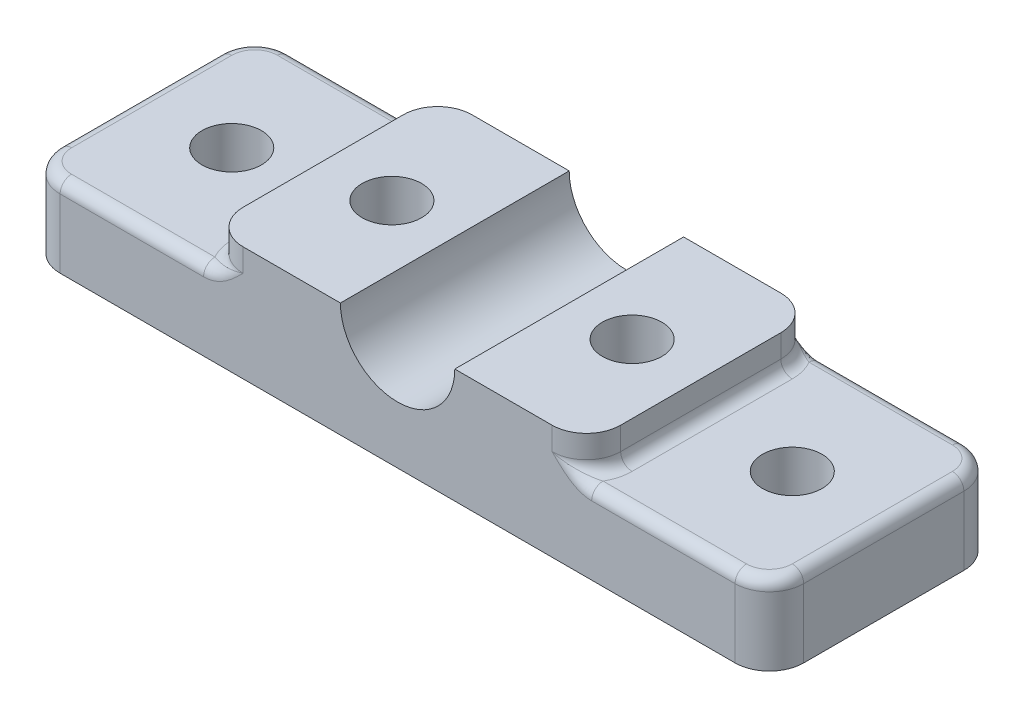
SolidWorks part; units mm, degrees
ref_plane "Front Plane" through (0, 0, 0) normal (0, 0, 1) x (1, 0, 0)
ref_plane "Top Plane" through (0, 0, 0) normal (0, 1, 0) x (1, 0, 0)
ref_plane "Right Plane" through (0, 0, 0) normal (1, 0, 0) x (0, 0, -1)
sketch "Sketch1" plane through (0, 0, 0) normal (0, 1, 0) x (1, 0, 0)
  line L0 (-50.7915, 0) -> (50.7915, 0) construction
  line L1 (0, 10) -> (0, -10) construction
  line L2 (-29.5, -10) -> (29.5, -10)
  line L3 (-32.5, -7) -> (-32.5, 7)
  line L4 (-29.5, 10) -> (29.5, 10)
  line L5 (32.5, -7) -> (32.5, 7)
  line L6 (-32.5, -10) -> (32.5, 10) construction
  line L7 (-32.5, 10) -> (32.5, -10) construction
  line L8 (-16.5, -10) -> (16.5, -10) construction
  line L9 (-16.5, -10) -> (-16.5, 10) construction
  line L10 (-16.5, 10) -> (16.5, 10) construction
  line L11 (16.5, -10) -> (16.5, 10) construction
  line L12 (-16.5, -10) -> (16.5, 10) construction
  line L13 (-16.5, 10) -> (16.5, -10) construction
  arc A0 (-32.5, -7) -> (-29.5, -10) centre (-29.5, -7) ccw
  arc A1 (29.5, -10) -> (32.5, -7) centre (29.5, -7) ccw
  arc A2 (32.5, 7) -> (29.5, 10) centre (29.5, 7) ccw
  arc A3 (-29.5, 10) -> (-32.5, 7) centre (-29.5, 7) ccw
  circle A4 centre (-10.5, 0) radius 2.6
  circle A5 centre (-24.5, 0) radius 2.6
  circle A6 centre (24.5, 0) radius 2.6
  circle A7 centre (10.5, 0) radius 2.6
  point P3 (0, 0)
  point P4 (0, 0)
  point P25 (0, 0)
  dimension "D3" = 3
  dimension "D4" = 5.2
  dimension "D7" = 14
  dimension "D1" = 65
  dimension "D2" = 20
  dimension "D5" = 33
  dimension "D6" = 10.5
extrude "Boss-Extrude1" add sketch "Sketch1" along normal blind 7
sketch "Sketch2" plane through (0, 7, 0) normal (0, 1, 0) x (1, 0, 0)
  line L0 (29.5, 10) -> (-29.5, 10) construction
  line L1 (-13.5, -10) -> (13.5, -10)
  line L2 (-16.5, -7) -> (-16.5, 7)
  line L3 (-13.5, 10) -> (13.5, 10)
  line L4 (16.5, -7) -> (16.5, 7)
  line L5 (-16.5, -10) -> (16.5, 10) construction
  line L6 (-16.5, 10) -> (16.5, -10) construction
  arc A0 (13.5, 10) -> (16.5, 7) centre (13.5, 7) cw
  arc A1 (16.5, -7) -> (13.5, -10) centre (13.5, -7) cw
  arc A2 (-13.5, -10) -> (-16.5, -7) centre (-13.5, -7) cw
  arc A3 (-16.5, 7) -> (-13.5, 10) centre (-13.5, 7) cw
  circle A4 centre (-10.5, 0) radius 2.6 construction
  circle A5 centre (10.5, 0) radius 2.6 construction
  circle A6 centre (-10.5, 0) radius 2.6
  circle A7 centre (10.5, 0) radius 2.6
  point P0 (0, 0)
  dimension "D2" = 3
  dimension "D1" = 33
extrude "Boss-Extrude2" add sketch "Sketch2" along normal blind 3
sketch "Sketch3" plane through (0, 0, 10) normal (0, 0, 1) x (1, 0, 0)
  line L0 (0, 0) -> (0, 16.2371) construction
  line L1 (-29.5, 0) -> (29.5, 0) construction
  circle A0 centre (0, 10) radius 5
  dimension "D1" = 10
  dimension "D2" = 10
extrude "Cut-Extrude1" cut sketch "Sketch3" against normal up to surface (20 mm away)
sketch "Sketch4" plane through (0, 0, 0) normal (0, -1, 0) x (1, 0, 0)
  line L0 (-32.5, -7) -> (-32.5, 7) construction
  line L1 (-10.5, 4.6188) -> (-14.5, 2.3094)
  line L2 (-14.5, 2.3094) -> (-14.5, -2.3094)
  line L3 (-14.5, -2.3094) -> (-10.5, -4.6188)
  line L4 (-10.5, -4.6188) -> (-6.5, -2.3094)
  line L5 (-6.5, -2.3094) -> (-6.5, 2.3094)
  line L6 (-6.5, 2.3094) -> (-10.5, 4.6188)
  line L7 (14.5, 2.3094) -> (10.5, 4.6188)
  line L8 (10.5, 4.6188) -> (6.5, 2.3094)
  line L9 (6.5, 2.3094) -> (6.5, -2.3094)
  line L10 (6.5, -2.3094) -> (10.5, -4.6188)
  line L11 (10.5, -4.6188) -> (14.5, -2.3094)
  line L12 (14.5, -2.3094) -> (14.5, 2.3094)
  line L13 (32.5, 7) -> (32.5, -7) construction
  circle A0 centre (-10.5, 0) radius 4 construction
  circle A1 centre (10.5, 0) radius 4 construction
  dimension "D1" = 8
extrude "Cut-Extrude2" cut sketch "Sketch4" against normal blind 5
fillet "Fillet1" radius 1 16 edges at (-16.5, 7, 0) (16.5, 7, 0) (31.6213, 7, -9.1213) (32.5, 7, 0) (-31.6213, 7, -9.1213) (-32.5, 7, 0) (31.6213, 7, 9.1213) (-31.6213, 7, 9.1213)
